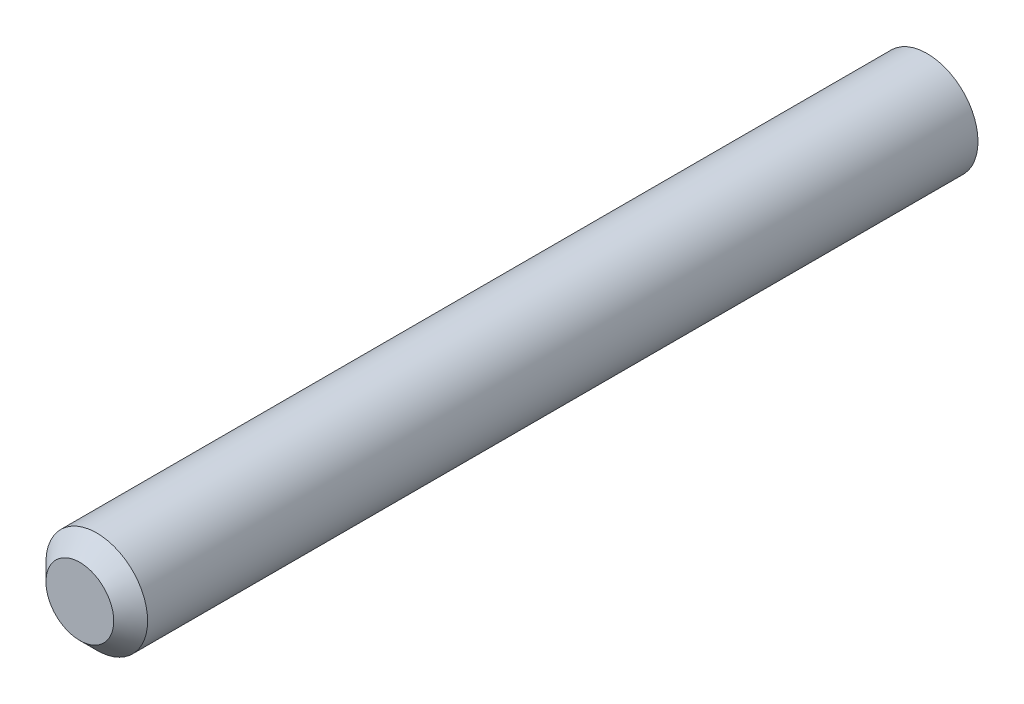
SolidWorks part; units mm, degrees
ref_plane "Plan de face" through (0, 0, 0) normal (0, 0, 1) x (1, 0, 0)
ref_plane "Plan de dessus" through (0, 0, 0) normal (0, 1, 0) x (1, 0, 0)
ref_plane "Plan de droite" through (0, 0, 0) normal (1, 0, 0) x (0, 0, -1)
sketch "Esquisse2" plane through (0, 0, 0) normal (0, 0, 1) x (1, 0, 0)
  circle A0 centre (0, 0) radius 3
  dimension "D1" = 6
extrude "Extrusion1" add sketch "Esquisse2" along normal blind 50
chamfer "Chanfrein1" distance 1 angle 45 1 edges at (3, 0, 50)
